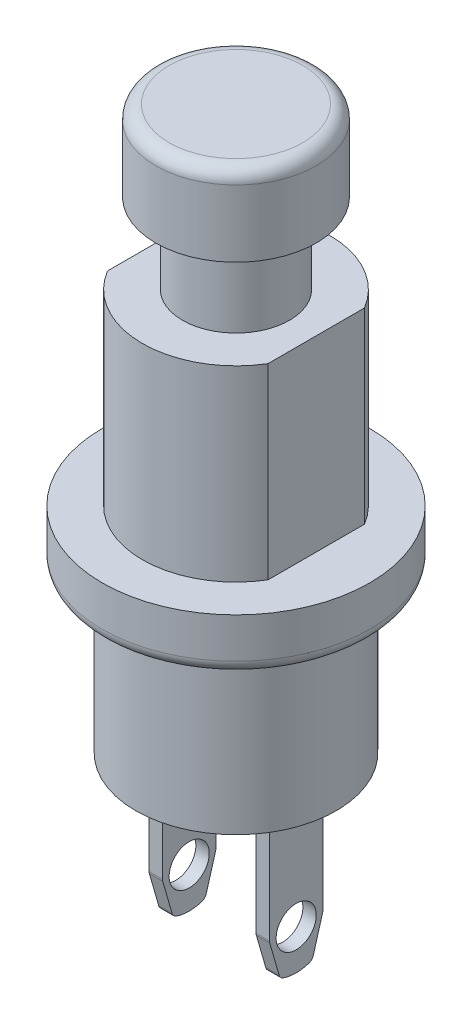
SolidWorks part; units mm, degrees
ref_plane "Front" through (0, 0, 0) normal (0, 0, 1) x (1, 0, 0)
ref_plane "Top" through (0, 0, 0) normal (0, 1, 0) x (1, 0, 0)
ref_plane "Right" through (0, 0, 0) normal (1, 0, 0) x (0, 0, -1)
sketch "Sketch1" plane through (0, 0, 0) normal (0, 1, 0) x (1, 0, 0)
  circle A0 centre (0, 0) radius 3.75
extrude "Extrude1" add sketch "Sketch1" along normal blind 6
sketch "Sketch2" plane through (0, 0, 0) normal (0, -1, 0) x (1, 0, 0)
  line L2 (-1.75, 1.5) -> (-1.75, -1.5)
  line L3 (1.75, 1.5) -> (1.75, -1.5)
  line L4 (-2.25, 1.5) -> (-2.25, -1.5)
  line L5 (2.25, 1.5) -> (2.25, -1.5)
  line L6 (-2.25, 1.5) -> (-1.75, 1.5)
  line L7 (-2.25, -1.5) -> (-1.75, -1.5)
  line L8 (2.25, 3.75) -> (2.25, -3.75) construction
  line L9 (1.75, 3.75) -> (1.75, -3.75) construction
  line L11 (-1.75, 3.75) -> (-1.75, -3.75) construction
  line L12 (-2.25, 3.75) -> (-2.25, -3.75) construction
  line L16 (1.75, 1.5) -> (2.25, 1.5)
  line L18 (1.75, -1.5) -> (2.25, -1.5)
extrude "Extrude2" add sketch "Sketch2" along normal blind 6
sketch "Sketch3" plane through (-2.25, 0, 0) normal (-1, 0, 0) x (0, 0, 1)
  line L0 (-1.5, -0.5) -> (-1, -0.5)
  line L3 (-3.75, 0) -> (-1.5, 0)
  line L4 (1.5, 0) -> (3.75, 0)
  line L5 (1.5, -0.5) -> (1, -0.5)
  line L6 (1, -0.5) -> (1, -4.4647)
  line L7 (-1, -0.5) -> (-1, -4.4647)
  line L8 (-1.5, 0) -> (-1.5, -0.5)
  line L9 (-0.9902, -4.5339) -> (-0.6385, -5.7541)
  line L10 (0.9902, -4.5339) -> (0.6385, -5.7541)
  line L11 (1.5, 0) -> (1.5, -0.5)
  line L13 (-3.75, 0) -> (-3.75, -6.1579)
  line L14 (-3.75, -6.1579) -> (3.6537, -6.1579)
  line L15 (3.6537, -6.1579) -> (3.6537, 0)
  arc A0 (-0.9902, -4.5339) -> (-1, -4.4647) centre (-0.75, -4.4647) cw
  arc A1 (-0.4779, -5.9218) -> (0.4779, -5.9218) centre (0, -4.5) ccw
  circle A2 centre (0, -4.5) radius 0.75
  arc A3 (-0.4779, -5.9218) -> (-0.6385, -5.7541) centre (-0.3983, -5.6849) cw
  arc A4 (0.6385, -5.7541) -> (0.4779, -5.9218) centre (0.3983, -5.6849) cw
  arc A5 (0.9902, -4.5339) -> (1, -4.4647) centre (0.75, -4.4647) ccw
extrude "Cut-Extrude5" cut sketch "Sketch3" against normal through all contours A1 A3 L9 A0 L7 L0 M2 M3 | A2 | A5 L10 A4 A1 L5 L6 M3 M4
sketch "Sketch4" plane through (0, 6, 0) normal (0, 1, 0) x (-1, 0, 0)
  circle A0 centre (0, 0) radius 5
extrude "Extrude3" add sketch "Sketch4" along normal blind 2
fillet "Fillet1" radius 0.5 1 edges at (0, 6, 5)
sketch "Sketch5" plane through (0, 8, 0) normal (0, 1, 0) x (-1, 0, 0)
  line L1 (-3, 1.8028) -> (-3, -1.8028)
  line L2 (3, 1.8028) -> (3, -1.8028)
  arc A0 (-3, -1.8028) -> (3, -1.8028) centre (0, 0) ccw
  arc A2 (3, 1.8028) -> (-3, 1.8028) centre (0, 0) ccw
extrude "Extrude4" add sketch "Sketch5" along normal blind 7
sketch "Sketch6" plane through (0, 15, 0) normal (0, 1, 0) x (-1, 0, 0)
  circle A0 centre (0, 0) radius 2
extrude "Extrude5" add sketch "Sketch6" along normal blind 3
sketch "Sketch7" plane through (0, 18, 0) normal (0, 1, 0) x (-1, 0, 0)
  circle A0 centre (0, 0) radius 3
extrude "Extrude6" add sketch "Sketch7" along normal blind 3
fillet "Fillet2" radius 0.5 1 edges at (0, 21, 3)
